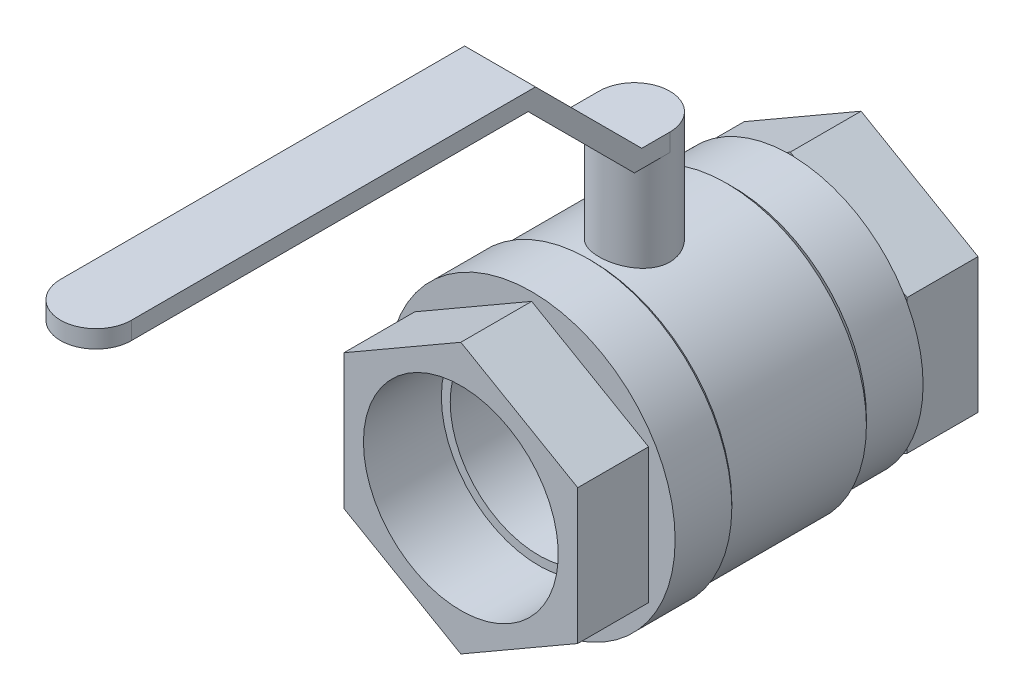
SolidWorks part; units mm, degrees
ref_plane "Plan1" through (0, 0, 0) normal (0, 0, 1) x (1, 0, 0)
ref_plane "Plan2" through (0, 0, 0) normal (0, 1, 0) x (1, 0, 0)
ref_plane "Plan3" through (0, 0, 0) normal (1, 0, 0) x (0, 0, -1)
sketch "Esquisse1" plane through (0, 0, 0) normal (0, 1, 0) x (1, 0, 0)
  line L0 (0, 108) -> (0, -70) construction
  line L1 (0, 0) -> (40, 0)
  line L2 (40, 0) -> (40, 20)
  line L3 (40, 20) -> (40.5, 20)
  line L4 (40.5, 20) -> (40.5, 36)
  line L5 (40.5, 36) -> (39.5, 37)
  line L6 (39.5, 37) -> (39.5, 75)
  line L7 (39.5, 75) -> (37.5, 77)
  line L8 (37.5, 77) -> (37.5, 93)
  line L9 (37.5, 93) -> (40, 93)
  line L10 (40, 93) -> (40, 113)
  line L11 (40, 113) -> (0, 113)
  line L12 (0, 113) -> (0, 0)
  dimension "D1" = 20
  dimension "D2" = 16
  dimension "D3" = 20
  dimension "D4" = 16
  dimension "D5" = 45
  dimension "D6" = 113
  dimension "D7" = 80
  dimension "D8" = 81
  dimension "D9" = 79
  dimension "D10" = 75
  dimension "D11" = 80
  dimension "D12" = 45
revolve "Base-Révolution" add sketch "Esquisse1" angle 360 about L0
sketch "Esquisse2" plane through (0, 0, 0) normal (0, 0, 1) x (1, 0, 0)
  line L1 (33, -19.0526) -> (33, 19.0526)
  line L2 (33, 19.0526) -> (0, 38.1051)
  line L3 (0, 38.1051) -> (-33, 19.0526)
  line L4 (-33, 19.0526) -> (-33, -19.0526)
  line L5 (-33, -19.0526) -> (0, -38.1051)
  line L6 (0, -38.1051) -> (33, -19.0526)
  circle A0 centre (0, 0) radius 33 construction
  dimension "D1" = 66
extrude "Enlèv. mat.-Extru.1" cut sketch "Esquisse2" against normal blind 20 flip side to cut
sketch "Esquisse3" plane through (0, 0, -113) normal (0, 0, -1) x (-1, 0, 0)
  line L13 (-33, -19.0526) -> (0, -38.1051)
  line L14 (-33, 19.0526) -> (-33, -19.0526)
  line L15 (0, 38.1051) -> (-33, 19.0526)
  line L16 (33, 19.0526) -> (0, 38.1051)
  line L17 (33, -19.0526) -> (33, 19.0526)
  line L18 (0, -38.1051) -> (33, -19.0526)
  line L19 (-33, -19.0526) -> (0, -38.1051)
  line L20 (-33, 19.0526) -> (-33, -19.0526)
  line L21 (0, 38.1051) -> (-33, 19.0526)
  line L22 (33, 19.0526) -> (0, 38.1051)
  line L23 (33, -19.0526) -> (33, 19.0526)
  line L24 (0, -38.1051) -> (33, -19.0526)
  dimension "D1" = 0
extrude "Enlèv. mat.-Extru.3" cut sketch "Esquisse3" against normal up to surface (20 mm away) flip side to cut
sketch "Esquisse7" plane through (0, 0, 0) normal (0, 1, 0) x (1, 0, 0)
  line L0 (0, 108) -> (0, -70) construction
  line L2 (0, 113) -> (33, 113) construction
  circle A0 centre (0, 49) radius 10
  dimension "D2" = 20
  dimension "D1" = 64
extrude "Boss.-Extru.2" add sketch "Esquisse7" along normal blind 70
ref_plane "Plan4" through (0, 0, -49) normal (0, 0, -1) x (-1, 0, 0)
sketch "Esquisse9" plane through (0, 0, -49) normal (1, 0, 0) x (0, 0, -1)
  line L1 (0, 65) -> (-10, 65)
  line L2 (-10, 65) -> (-40, 95)
  line L3 (-40, 95) -> (-163, 95)
  line L5 (10, 70) -> (-10, 70) construction
  line L6 (0, 70) -> (0, 39.5) construction
  dimension "D1" = 163
  dimension "D2" = 10
  dimension "D3" = 30
  dimension "D4" = 45
  dimension "D5" = 5
  dimension "D6" = 95
extrude "Boss.-Extru.-Mince4" add sketch "Esquisse9" along normal mid plane 20 thin
sketch "Esquisse10" plane through (0, 100, 0) normal (0, 1, 0) x (-1, 0, 0)
  line L1 (-10, -11.0711) -> (-10, 114) construction
  line L2 (-10, 114) -> (10, 114) construction
  line L3 (10, -11.0711) -> (10, 114) construction
  line L4 (-10, 103) -> (-10, 114)
  line L5 (-10, 114) -> (10, 114)
  line L6 (10, 103) -> (10, 114)
  arc A0 (10, 103) -> (-10, 103) centre (0, 103) ccw
  dimension "D1" = 162
extrude "Enlèv. mat.-Extru.6" cut sketch "Esquisse10" against normal through all
sketch "Esquisse11" plane through (0, 0, 0) normal (0, 1, 0) x (1, 0, 0)
  line L0 (0, 64) -> (0, -11) construction
  line L1 (0, 108) -> (0, -70) construction
  line L2 (-27.5, 113) -> (-27.5, 91)
  line L4 (-27.5, 91) -> (-25, 91)
  line L5 (-25, 91) -> (-25, 22)
  line L6 (-25, 22) -> (-27.5, 22)
  line L7 (-27.5, 22) -> (-27.5, 0)
  line L8 (-27.5, 0) -> (0, 0)
  line L9 (0, 0) -> (0, 113)
  line L10 (0, 113) -> (-27.5, 113)
  line L12 (-33, 113) -> (0, 113) construction
  dimension "D1" = 55
  dimension "D2" = 50
  dimension "D3" = 22
revolve "Enlèvement de matière-Révolution1" cut sketch "Esquisse11" angle 360 about L0
